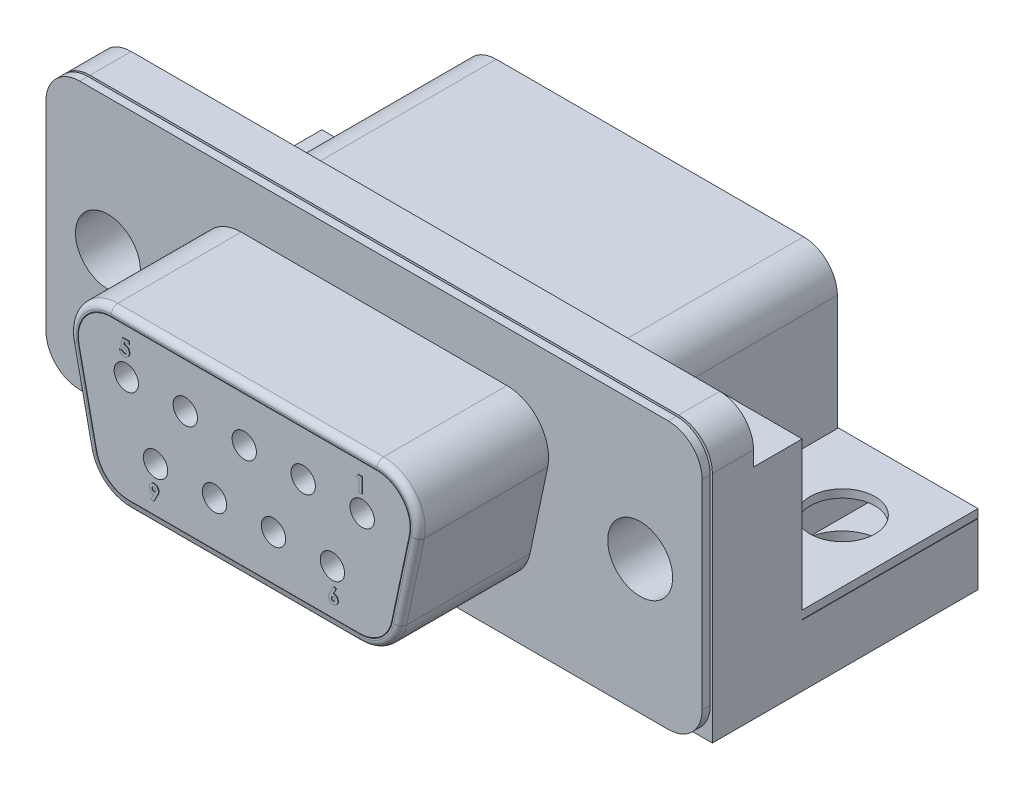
SolidWorks part; units mm, degrees
ref_plane "Спереди" through (0, 0, 0) normal (0, 0, 1) x (1, 0, 0)
ref_plane "Сверху" through (0, 0, 0) normal (0, 1, 0) x (1, 0, 0)
ref_plane "Справа" through (0, 0, 0) normal (1, 0, 0) x (0, 0, -1)
imported_body "Импортированный1"
sketch "Эскиз1" plane through (0, 0, -0.381) normal (0, 0, -1) x (-1, 0, 0)
  line L0 (15.4051, 0) -> (-15.4051, 0) construction
  line L1 (-15.4051, 0) -> (-15.4051, 10.9601) construction
  line L2 (-13.8176, 12.5476) -> (13.8176, 12.5476) construction
  line L3 (15.4051, 10.9601) -> (15.4051, 0) construction
  line L4 (15.4051, 0) -> (-15.4051, 0)
  line L5 (-15.4051, 0) -> (-15.4051, 10.9601)
  line L6 (-13.8176, 12.5476) -> (13.8176, 12.5476)
  line L7 (15.4051, 10.9601) -> (15.4051, 0)
  line L8 (14.9051, 0.5) -> (-14.9051, 0.5)
  line L9 (-14.9051, 0.5) -> (-14.9051, 10.9601)
  line L10 (-13.8176, 12.0476) -> (13.8176, 12.0476)
  line L11 (14.9051, 10.9601) -> (14.9051, 0.5)
  arc A0 (-13.8176, 12.5476) -> (-15.4051, 10.9601) centre (-13.8176, 10.9601) ccw construction
  arc A1 (15.4051, 10.9601) -> (13.8176, 12.5476) centre (13.8176, 10.9601) ccw construction
  arc A2 (-13.8176, 12.5476) -> (-15.4051, 10.9601) centre (-13.8176, 10.9601) ccw
  arc A3 (15.4051, 10.9601) -> (13.8176, 12.5476) centre (13.8176, 10.9601) ccw
  arc A4 (-13.8176, 12.0476) -> (-14.9051, 10.9601) centre (-13.8176, 10.9601) ccw
  arc A5 (14.9051, 10.9601) -> (13.8176, 12.0476) centre (13.8176, 10.9601) ccw
  dimension "D1" = 0.5
extrude "Вытянуть1" cut sketch "Эскиз1" along normal blind 0.1
fillet "Скругление1" radius 1.5875 2 edges
